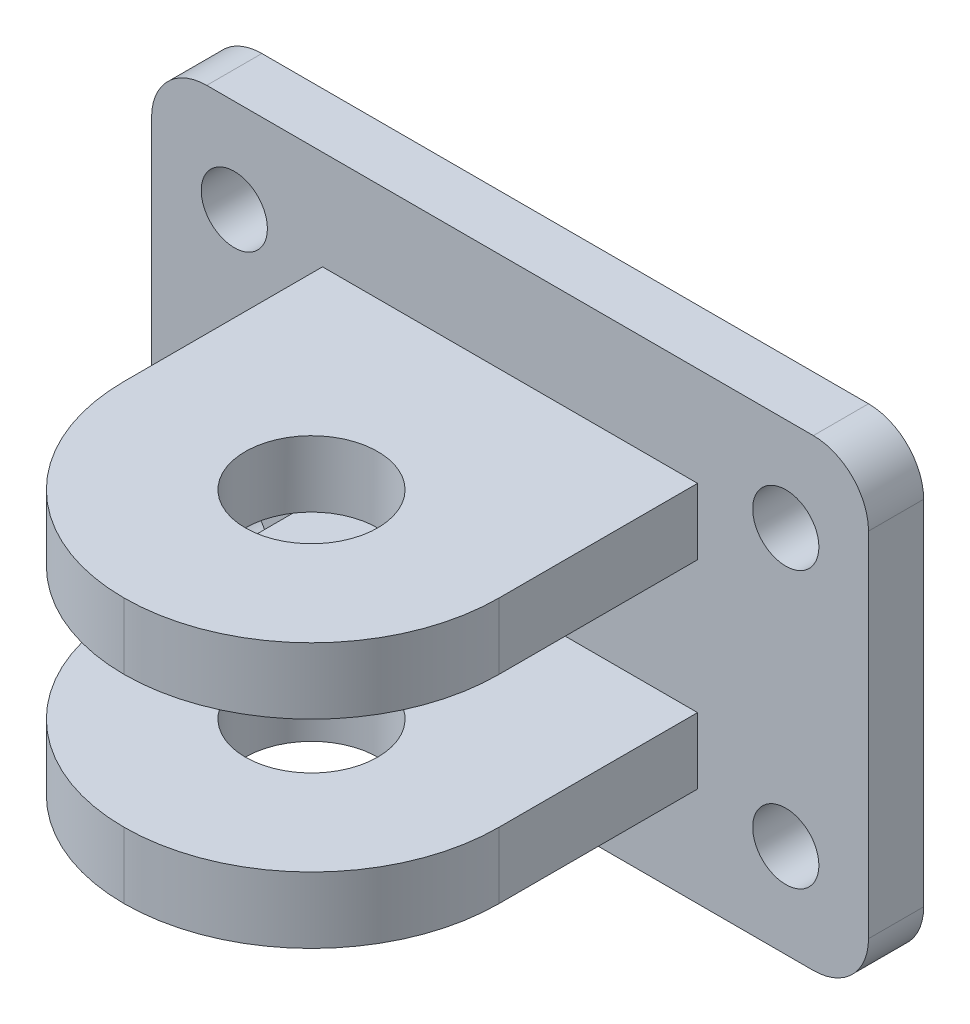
SolidWorks part; units mm, degrees
ref_plane "Face" through (0, 0, 0) normal (0, 0, 1) x (1, 0, 0)
ref_plane "Dessus" through (0, 0, 0) normal (0, 1, 0) x (1, 0, 0)
ref_plane "Droite" through (0, 0, 0) normal (1, 0, 0) x (0, 0, -1)
sketch "Esquisse1" plane through (0, 0, 0) normal (0, 0, 1) x (1, 0, 0)
  line L0 (0, 21) -> (0, -21) construction
  line L2 (-32.5, 21) -> (32.5, 21)
  line L3 (-32.5, 21) -> (-32.5, -21)
  line L4 (-32.5, -21) -> (32.5, -21)
  line L5 (32.5, 21) -> (32.5, -21)
  dimension "D1" = 42
  dimension "D2" = 65
extrude "Base-Extrusion" add sketch "Esquisse1" along normal blind 5
sketch "Esquisse2" plane through (0, 0, 5) normal (0, 0, 1) x (1, 0, 0)
  line L0 (25, 12.5) -> (25, -12.5) construction
  line L1 (25, 12.5) -> (-25, 12.5) construction
  line L2 (25, -12.5) -> (-25, -12.5) construction
  line L3 (-25, -12.5) -> (-25, 12.5) construction
  line L4 (0, 12.5) -> (0, -12.5) construction
  circle A0 centre (25, 12.5) radius 3
  circle A1 centre (-25, 12.5) radius 3
  circle A2 centre (-25, -12.5) radius 3
  circle A3 centre (25, -12.5) radius 3
  dimension "D3" = 6
  dimension "D1" = 25
  dimension "D2" = 50
extrude "Enlèv. mat.-Extru.1" cut sketch "Esquisse2" against normal through all
sketch "Esquisse3" plane through (0, 0, 5) normal (0, 0, 1) x (1, 0, 0)
  line L0 (0, 6) -> (0, -6) construction
  line L1 (-17, 12) -> (17, 12)
  line L2 (-17, 12) -> (-17, 6)
  line L3 (-17, 6) -> (17, 6)
  line L4 (17, 12) -> (17, 6)
  line L5 (-17, -6) -> (17, -6)
  line L6 (-17, -6) -> (-17, -12)
  line L7 (-17, -12) -> (17, -12)
  line L8 (17, -6) -> (17, -12)
  dimension "D1" = 12
  dimension "D2" = 6
  dimension "D3" = 34
extrude "Boss.-Extru.1" add sketch "Esquisse3" along normal blind 35
fillet "Congé1" radius 17 8 edges at (-17, 9, 40) (0, 6, 40) (17, 9, 40) (0, 12, 40) (-17, -9, 40) (0, -12, 40) (17, -9, 40) (0, -6, 40)
sketch "Esquisse4" plane through (0, 12, 0) normal (0, 1, 0) x (-1, 0, 0)
  circle A0 centre (0, 23) radius 6
  arc A1 (0, 40) -> (-17, 23) centre (0, 23) ccw construction
  dimension "D1" = 12
extrude "Enlèv. mat.-Extru.2" cut sketch "Esquisse4" against normal through all
fillet "Congé2" radius 5 4 edges at (-32.5, 21, 2.5) (32.5, 21, 2.5) (32.5, -21, 2.5) (-32.5, -21, 2.5)
